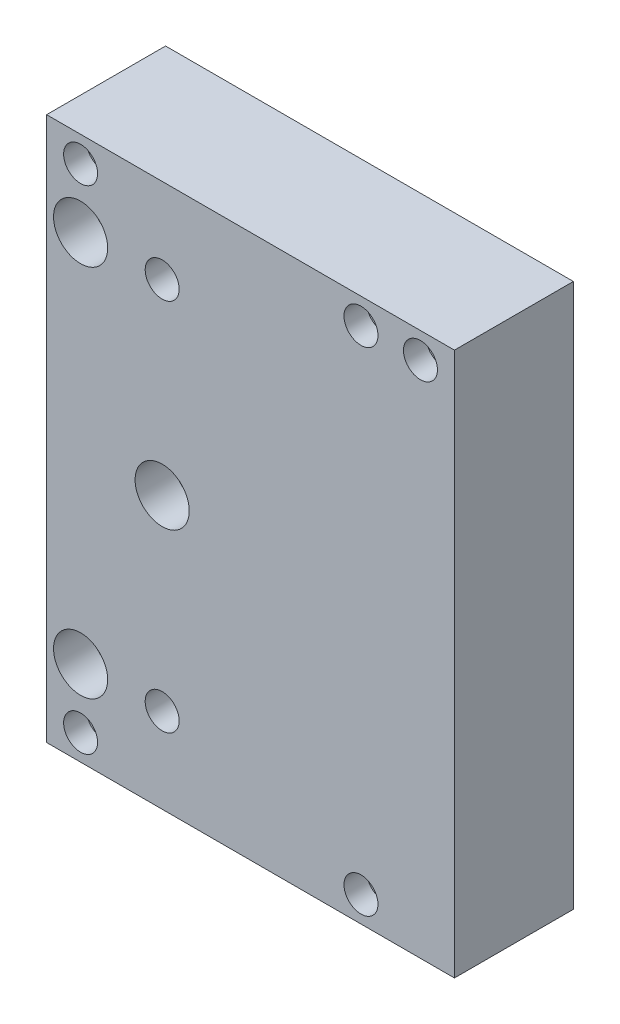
SolidWorks part; units mm, degrees
ref_plane "Front" through (0, 0, 0) normal (0, 0, 1) x (1, 0, 0)
ref_plane "Top" through (0, 0, 0) normal (0, 1, 0) x (1, 0, 0)
ref_plane "Right" through (0, 0, 0) normal (1, 0, 0) x (0, 0, -1)
sketch "Sketch1" plane through (0, 0, 0) normal (0, 0, 1) x (1, 0, 0)
  line L0 (-55.88, 0) -> (96.52, 0) construction
  line L1 (-55.88, 101.6) -> (96.52, 101.6)
  line L2 (-55.88, 101.6) -> (-55.88, -101.6)
  line L3 (-55.88, -101.6) -> (96.52, -101.6)
  line L4 (96.52, 101.6) -> (96.52, -101.6)
  line L6 (-57.15, 149.225) -> (-57.15, -180.975) construction
  line L8 (-101.6, 0) -> (-141.351, 0) construction
  dimension "D1" = 1.27
  dimension "D3" = 152.4
  dimension "D4" = 203.2
extrude "Boss-Extrude1" add sketch "Sketch1" along normal blind 44.45 separate body
hole_wizard "Hole1" positions "Point_Sketch" profile "Profil_Sketch" tap size "M1.6x0.35" standard "ISO"
sketch "Point_Sketch" plane through (81.4031, 101.6299, 44.45) normal (0, 0, -1) x (1, 0, 0)
  point P0 (2.4169, 9.6057)
  point P2 (-124.5831, 9.6057)
  point P4 (-19.8081, 9.6057)
  point P6 (-19.8081, 193.6541)
  point P8 (-124.5831, 193.6541)
sketch "Profil_Sketch" plane through (83.82, 92.0242, 44.45) normal (1, 0, 0) x (0, -1, 0)
  line L0 (0, 0) -> (0, 44.45)
  line L1 (0, 44.45) -> (3.9687, 44.45)
  line L2 (3.9687, 44.45) -> (3.9688, 8.4836)
  line L3 (6.35, 0) -> (6.35, 8.4836)
  line L4 (6.35, 8.4836) -> (3.9688, 8.4836)
  line L5 (6.35, 0) -> (0, 0)
  line L11 (0, -6.35) -> (0, 107.95) construction
  dimension "Thru Tap Drill Dia." = 7.9375
  dimension "Thru Tap Drill Depth" = 44.45
  dimension "L2" = 8.4836
other "usin_TL252<1>"
hole_wizard "Hole12" positions "Point_Sketch2" profile "Profil_Sketch2" hole size "Ø0.15" standard "ISO"
sketch "Point_Sketch2" plane through (-9.0457, 80.4511, 0) normal (0, 0, 1) x (-1, 0, 0)
  point P0 (3.6543, 10.6011)
  point P2 (3.6543, 150.3011)
sketch "Profil_Sketch2" plane through (-12.7, 69.85, 0) normal (1, 0, 0) x (0, 1, 0)
  line L0 (0, 0) -> (0, 44.45)
  line L1 (0, 44.45) -> (6.35, 44.45)
  line L2 (6.35, 44.45) -> (6.35, 0)
  line L5 (6.35, 0) -> (0, 0)
  line L11 (0, -6.35) -> (0, 107.95) construction
  dimension "Diameter" = 12.7
  dimension "Thru Hole Depth" = 44.45
other "usin_DL090_.500 x 2.00 DOWEL PIN<2>"
hole_wizard "Hole13" positions "Point_Sketch3" profile "Profil_Sketch3" counterbore size "1/4" standard "ANSI Inch"
sketch "Point_Sketch3" plane through (-56.0491, -68.915, 44.45) normal (0, 0, -1) x (1, 0, 0)
  point P0 (12.8691, 0.935)
  point P2 (43.3491, -68.915)
  point P4 (12.8691, -138.765)
sketch "Profil_Sketch3" plane through (-43.18, -69.85, 44.45) normal (1, 0, 0) x (0, -1, 0)
  line L0 (0, 0) -> (0, 44.45)
  line L1 (0, 44.45) -> (6.7437, 44.45)
  line L3 (6.7437, 44.45) -> (6.7437, 14.224)
  line L4 (6.7437, 14.224) -> (10.1219, 14.224)
  line L5 (10.1219, 14.224) -> (10.1219, 0)
  line L7 (10.1219, 0) -> (0, 0)
  line L11 (0, -6.35) -> (0, 107.95) construction
  dimension "Diameter" = 13.4874
  dimension "Thru Hole Depth" = 44.45
  dimension "L1" = 14.224
other "usin_LS160_.5-13x2-SHCS<1>"
